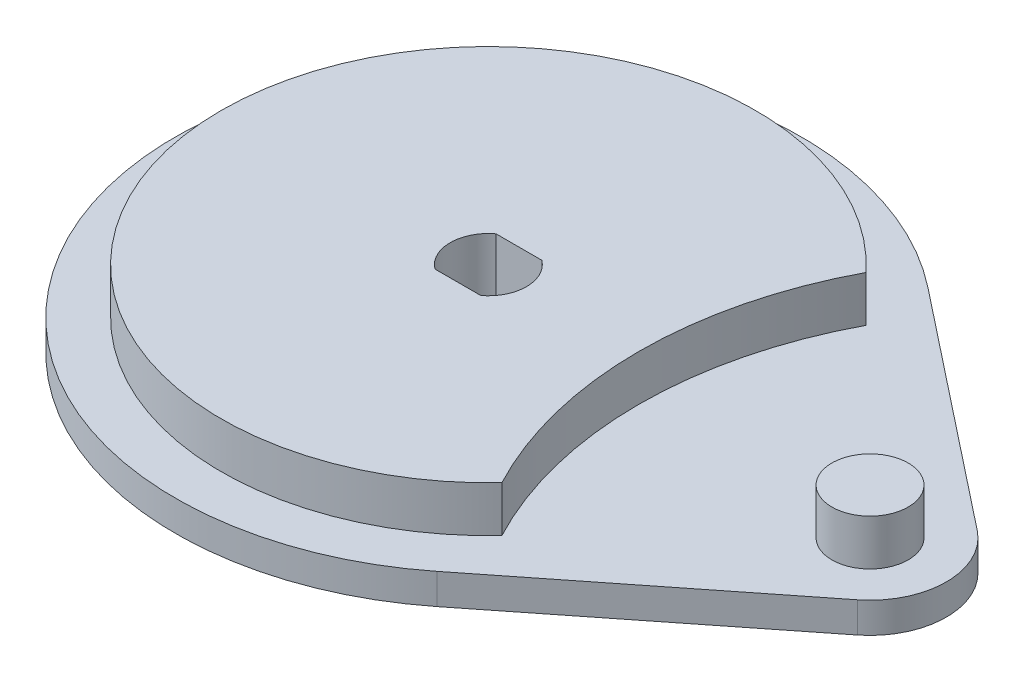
SolidWorks part; units mm, degrees
ref_plane "正面" through (0, 0, 0) normal (0, 0, 1) x (1, 0, 0)
ref_plane "平面" through (0, 0, 0) normal (0, 1, 0) x (1, 0, 0)
ref_plane "右側面" through (0, 0, 0) normal (1, 0, 0) x (0, 0, -1)
sketch "レイアウト" plane through (0, 0, 0) normal (0, 1, 0) x (1, 0, 0)
  line L0 (50, 0) -> (0, 0) construction
  circle A0 centre (0, 0) radius 41
  circle A1 centre (50, 0) radius 10
  dimension "D1" = 82
  dimension "D3" = 20
  dimension "D2" = 50
sketch "ｽｹｯﾁ2" plane through (0, 0, 0) normal (0, 1, 0) x (1, 0, 0)
  line L0 (25.42, 32.1687) -> (56.2, 7.846)
  line L1 (56.2, -7.846) -> (25.42, -32.1687)
  circle A0 centre (0, 0) radius 41 construction
  circle A1 centre (50, 0) radius 10 construction
  arc A2 (25.42, 32.1687) -> (25.42, -32.1687) centre (0, 0) ccw
  arc A3 (56.2, -7.846) -> (56.2, 7.846) centre (50, 0) ccw
extrude "押し出し1" add sketch "ｽｹｯﾁ2" along normal blind 4
sketch "ｽｹｯﾁ3" plane through (0, 0, 0) normal (0, 1, 0) x (1, 0, 0)
  circle A0 centre (0, 0) radius 35
  dimension "D1" = 70
extrude "押し出し2" add sketch "ｽｹｯﾁ3" along normal blind 10
sketch "ｽｹｯﾁ4" plane through (0, 10, 0) normal (0, 1, 0) x (1, 0, 0)
  line L0 (70.7, 0) -> (0, 0) construction
  circle A0 centre (70.7, 0) radius 51
  dimension "D1" = 51
  dimension "D2" = 70.7
extrude "ｶｯﾄ - 押し出し1" cut sketch "ｽｹｯﾁ4" against normal up to surface (6 mm away)
sketch "ｽｹｯﾁ5" plane through (0, 0, 0) normal (0, 1, 0) x (1, 0, 0)
  circle A0 centre (50, 0) radius 5
  dimension "D1" = 10
extrude "押し出し3" add sketch "ｽｹｯﾁ5" along normal blind 10
sketch "ｽｹｯﾁ6" plane through (0, 10, 0) normal (0, 1, 0) x (1, 0, 0)
  line L0 (-3, 4) -> (3, 4)
  line L1 (-3, -4) -> (3, -4)
  arc A0 (3, -4) -> (3, 4) centre (0, 0) ccw
  arc A1 (-3, 4) -> (-3, -4) centre (0, 0) ccw
  dimension "D1" = 10
  dimension "D2" = 8
extrude "ｶｯﾄ - 押し出し2" cut sketch "ｽｹｯﾁ6" against normal through all
